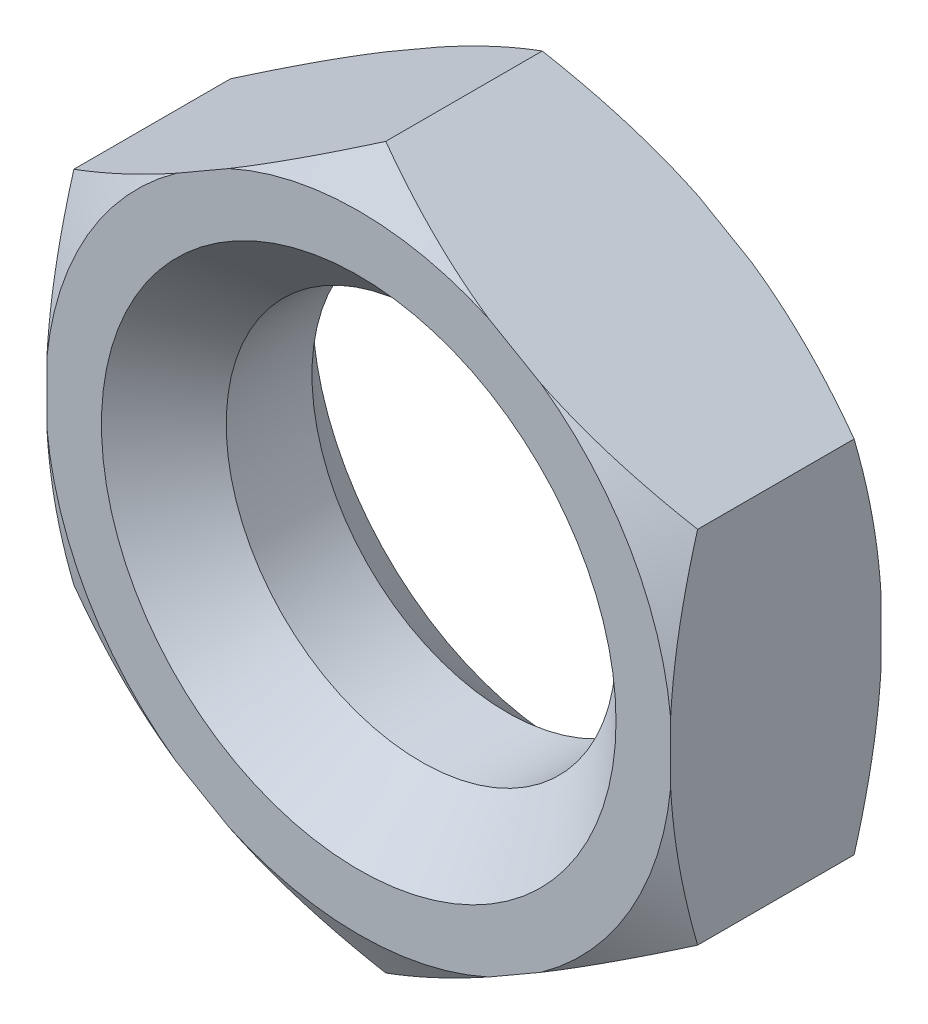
SolidWorks part; units mm, degrees
ref_plane "Front Plane" through (0, 0, 0) normal (0, 0, 1) x (1, 0, 0)
ref_plane "Top Plane" through (0, 0, 0) normal (0, 1, 0) x (1, 0, 0)
ref_plane "Right Plane" through (0, 0, 0) normal (1, 0, 0) x (0, 0, -1)
sketch "Sketch3" plane through (0, 0, 0) normal (0, 0, 1) x (1, 0, 0)
  line L1 (0, 4.6188) -> (-4, 2.3094)
  line L2 (-4, 2.3094) -> (-4, -2.3094)
  line L3 (-4, -2.3094) -> (0, -4.6188)
  line L4 (0, -4.6188) -> (4, -2.3094)
  line L5 (4, -2.3094) -> (4, 2.3094)
  line L6 (4, 2.3094) -> (0, 4.6188)
  circle A0 centre (0, 0) radius 4 construction
  dimension "D1" = 8
extrude "Boss-Extrude1" add sketch "Sketch3" along normal mid plane 2.7
sketch "Sketch4" plane through (0, 0, 0) normal (1, 0, 0) x (0, 0, -1)
  line L0 (-5.4578, 0) -> (6.1545, 0) construction
sketch "Sketch5" plane through (0, 0, 0) normal (1, 0, 0) x (0, 0, -1)
  line L0 (-1.35, 4.6188) -> (-1.35, 4.0188)
  line L1 (-1.35, 2.3094) -> (-1.35, 4.6188) construction
  line L2 (-1.35, 4.0188) -> (-1.0036, 4.6188)
  line L3 (-1.35, 4.6188) -> (1.35, 4.6188) construction
  line L4 (-1.0036, 4.6188) -> (-1.35, 4.6188)
  dimension "D1" = 0.6
  dimension "D2" = 30
revolve "Cut-Revolve1" cut sketch "Sketch5" angle 360 about L0
mirror "Mirror1" about plane through (0, 0, 0) normal (0, 0, 1) of "Cut-Revolve1"
sketch "Sketch6" plane through (0, 0, 1.35) normal (0, 0, 1) x (1, 0, 0)
  circle A0 centre (0, 0) radius 2.5
  dimension "D1" = 5
extrude "Cut-Extrude1" cut sketch "Sketch6" against normal blind 2.7
chamfer "Chamfer1" distance 0.8 angle 45 2 edges at (2.5, 0, -1.35) (2.5, 0, 1.35)
